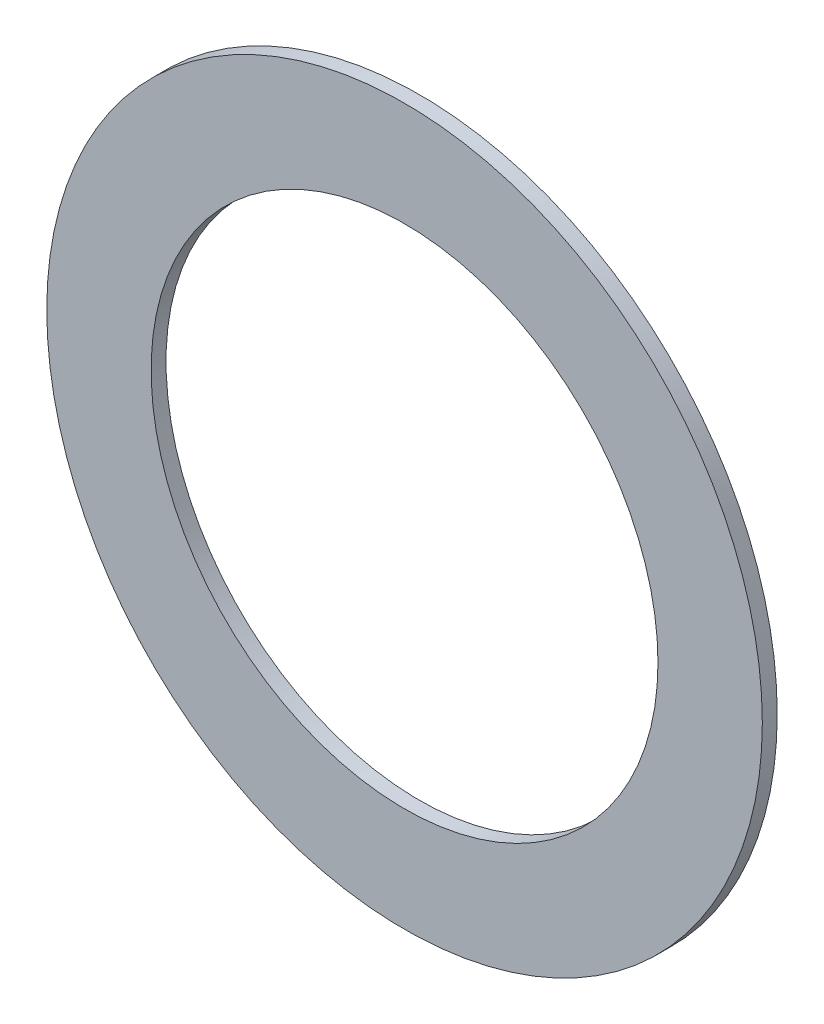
SolidWorks part; units mm, degrees
ref_plane "Plan de face" through (0, 0, 0) normal (0, 0, 1) x (1, 0, 0)
ref_plane "Plan de dessus" through (0, 0, 0) normal (0, 1, 0) x (1, 0, 0)
ref_plane "Plan de droite" through (0, 0, 0) normal (1, 0, 0) x (0, 0, -1)
sketch "Esquisse1" plane through (0, 0, 0) normal (0, 0, 1) x (1, 0, 0)
  circle A0 centre (0, 0) radius 8.5
  circle A1 centre (0, 0) radius 12
  dimension "D1" = 24
  dimension "D2" = 17
extrude "Extrusion1" add sketch "Esquisse1" along normal blind 0.5
